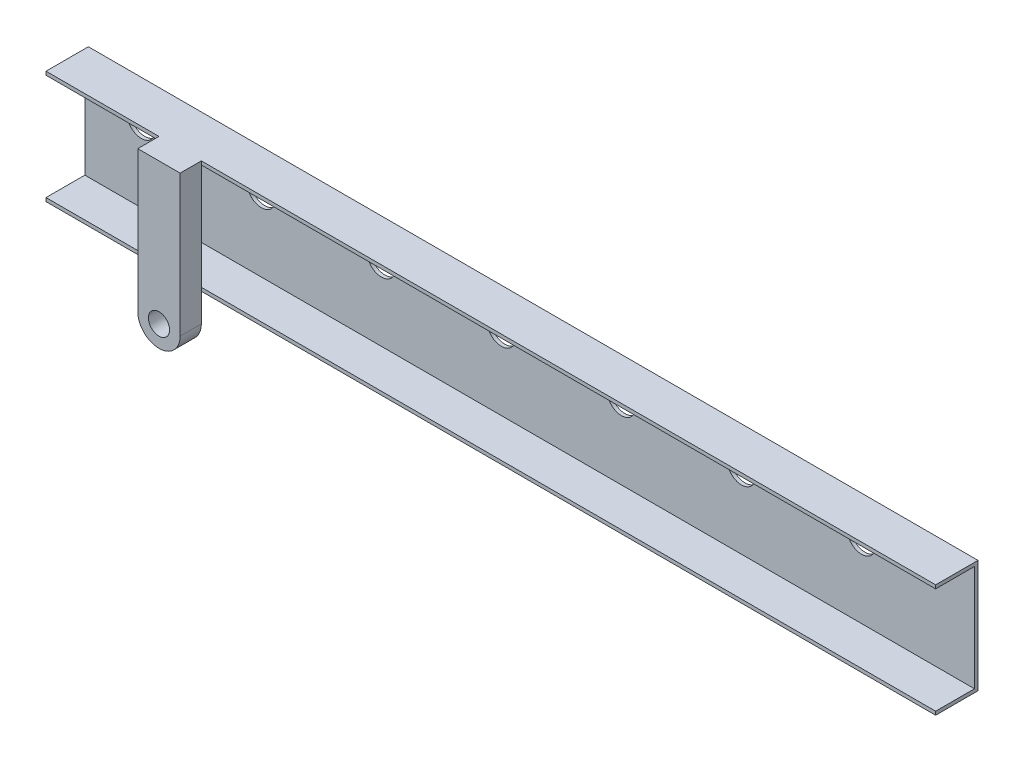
SolidWorks part; units mm, degrees
ref_plane "Plane1" through (0, 0, 0) normal (0, 0, 1) x (1, 0, 0)
ref_plane "Plane2" through (0, 0, 0) normal (0, 1, 0) x (1, 0, 0)
ref_plane "Plane3" through (0, 0, 0) normal (1, 0, 0) x (0, 0, -1)
sketch "Sketch1" plane through (0, 0, 0) normal (1, 0, 0) x (0, 0, -1)
  line L0 (0, 0) -> (0, -101.6)
  line L1 (0, -101.6) -> (-38.1, -101.6)
  line L2 (0, 0) -> (-38.1, 0)
  line L3 (-38.1, -101.6) -> (-38.1, 0) construction
  dimension "D1" = 38.1
  dimension "D2" = 101.6
extrude "Base-Extrude-Thin" add sketch "Sketch1" along normal blind 800.1 thin
sketch "Sketch2" plane through (0, 0, 0) normal (0, 0, -1) x (-1, 0, 0)
  line L0 (0, 0) -> (0, -101.6) construction
  line L1 (-800.1, 0) -> (0, 0) construction
  circle A0 centre (-50.8, -31.75) radius 12.7
  dimension "D1" = 25.4
  dimension "D2" = 50.8
  dimension "D3" = 31.75
extrude "Cut-Extrude1" cut sketch "Sketch2" against normal through all
pattern_linear "LPattern1" count 7 spacing 107.95 along (1, 0, 0) of "Cut-Extrude1"
sketch "Sketch3"
  line L0 (-669.7154, -54.5194) -> (-631.6154, -54.5194)
  line L1 (-669.7154, -54.5194) -> (-669.7154, -181.5194)
  line L3 (-631.6154, -181.5194) -> (-631.6154, -54.5194)
  line L7 (28.7846, -54.5194) -> (-771.3154, -54.5194) construction
  line L8 (-771.3154, -57.6944) -> (-771.3154, -152.9444) construction
  arc A0 (-631.6154, -181.5194) -> (-669.7154, -181.5194) centre (-650.6654, -181.5194) cw
  circle A1 centre (-650.6654, -181.5194) radius 9.525
  dimension "D4" = 19.05
  dimension "D1" = 38.1
  dimension "D2" = 127
  dimension "D3" = 101.6
extrude "Boss-Extrude1" add sketch "Sketch3" along normal blind 19.05
